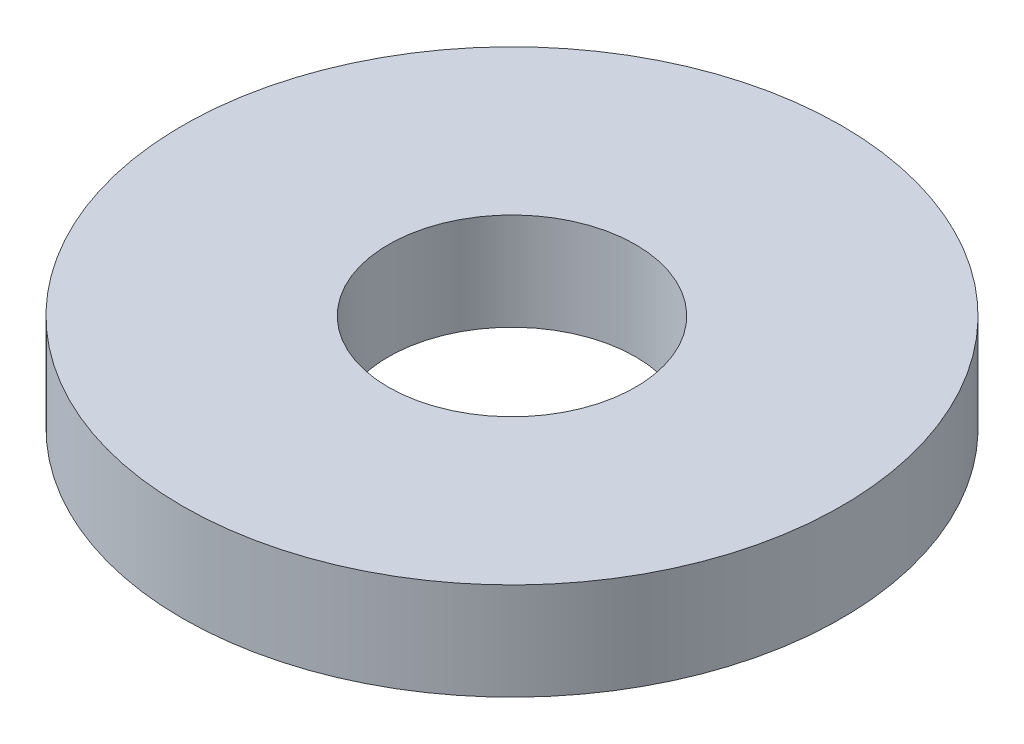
SolidWorks part; units mm, degrees
ref_plane "Front Plane" through (0, 0, 0) normal (0, 0, 1) x (1, 0, 0)
ref_plane "Top Plane" through (0, 0, 0) normal (0, 1, 0) x (1, 0, 0)
ref_plane "Right Plane" through (0, 0, 0) normal (1, 0, 0) x (0, 0, -1)
sketch "Sketch1" plane through (0, 0, 0) normal (0, 1, 0) x (1, 0, 0)
  circle A0 centre (0, 0) radius 10.16
  circle A1 centre (0, 0) radius 3.81
  dimension "D1" = 7.62
  dimension "D2" = 20.32
extrude "Boss-Extrude1" add sketch "Sketch1" along normal blind 2.9972
